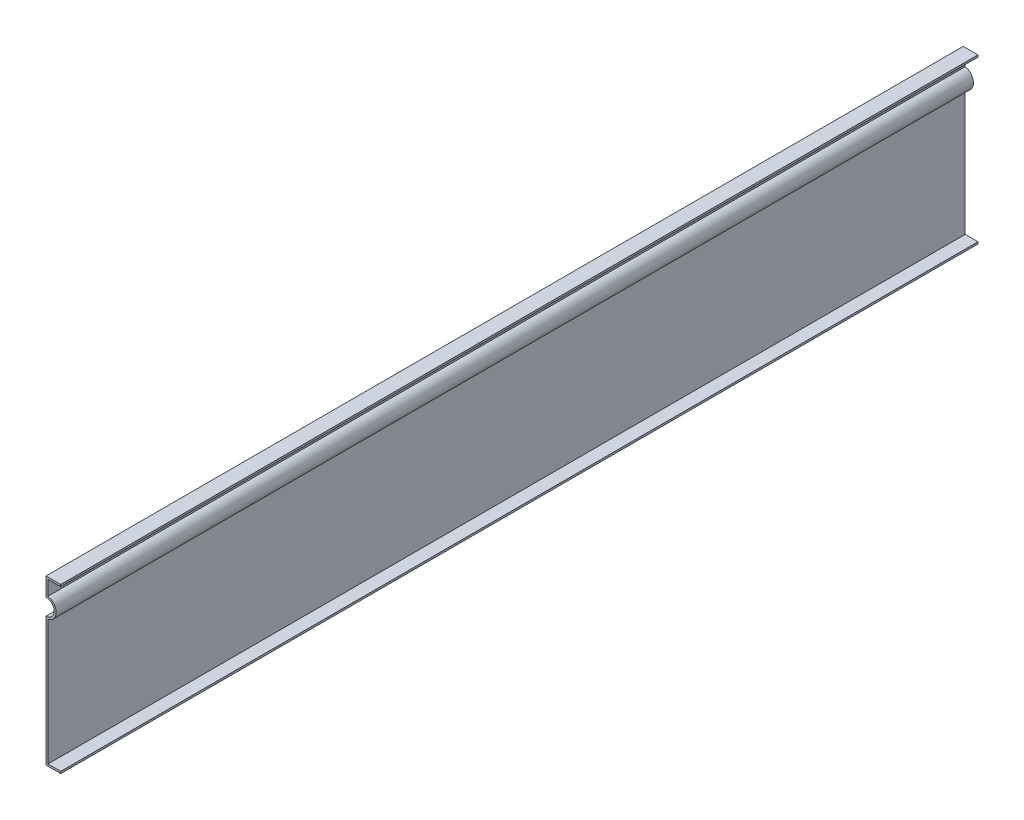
SolidWorks part; units mm, degrees
ref_plane "Front Plane" through (0, 0, 0) normal (0, 0, 1) x (1, 0, 0)
ref_plane "Top Plane" through (0, 0, 0) normal (0, 1, 0) x (1, 0, 0)
ref_plane "Right Plane" through (0, 0, 0) normal (1, 0, 0) x (0, 0, -1)
sketch "Sketch1" plane through (0, 0, 0) normal (0, 0, 1) x (1, 0, 0)
  line L0 (0, 0) -> (-7.786, 0)
  line L1 (-7.786, 0) -> (-7.786, 76.4777)
  line L2 (-7.786, 88.6663) -> (-7.786, 97.572)
  line L3 (-7.786, 97.572) -> (0, 97.572)
  line L4 (0, 97.572) -> (0, 98.786)
  line L5 (0, 98.786) -> (-9, 98.786)
  line L6 (-9, 98.786) -> (-9, 87.572)
  line L7 (-9, 77.572) -> (-9, -1.214)
  line L8 (-9, -1.214) -> (0, -1.214)
  line L9 (0, -1.214) -> (0, 0)
  arc A0 (-7.786, 88.6663) -> (-7.786, 76.4777) centre (-9, 82.572) cw
  arc A1 (-9, 87.572) -> (-9, 77.572) centre (-9, 82.572) cw
  dimension "D5" = 1.214
  dimension "D6" = 5
  dimension "D1" = 1.214
  dimension "D2" = 9
  dimension "D3" = 1.214
  dimension "D4" = 1.214
  dimension "D7" = 15
  dimension "D8" = 100
extrude "Extrude1" add sketch "Sketch1" along normal blind 560
